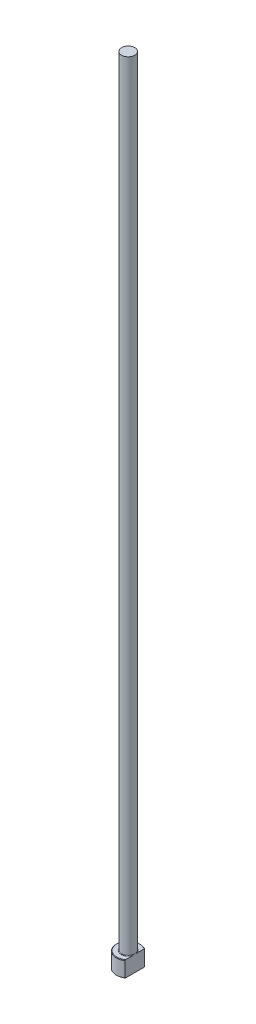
SolidWorks part; units mm, degrees
ref_plane "Front Plane" through (0, 0, 0) normal (0, 0, 1) x (1, 0, 0)
ref_plane "Top Plane" through (0, 0, 0) normal (0, 1, 0) x (1, 0, 0)
ref_plane "Right Plane" through (0, 0, 0) normal (1, 0, 0) x (0, 0, -1)
sketch "Sketch1" plane through (0, 0, 0) normal (0, 0, 1) x (1, 0, 0)
  line L0 (0, 259.9588) -> (0, -15.1925) construction
  line L1 (0, 0) -> (-4.5, 0)
  line L2 (-4.5, 0) -> (-4.5, 6)
  line L3 (-4.5, 6) -> (-2.5, 6)
  line L4 (-2.5, 6) -> (-2.5, 300)
  line L5 (-2.5, 300) -> (0, 300)
  line L6 (0, 300) -> (0, 0)
  dimension "L" = 300
  dimension "H" = 9
  dimension "T" = 6
  dimension "D" = 5
revolve "Revolve1" add sketch "Sketch1" angle 360 about L0
chamfer "Chamfer1" distance 0.2 angle 45 2 edges at (0, 6, 4.5) (0, 0, 4.5)
fillet "Fillet1" radius 0.2 1 edges at (0, 6, 2.5)
sketch "Sketch2" plane through (0, 0, 0) normal (0, 1, 0) x (1, 0, 0)
  line L0 (2.5, -3.7417) -> (2.5, 3.7417)
  circle A0 centre (0, 0) radius 4.5 construction
  arc A1 (2.5, -3.7417) -> (2.5, 3.7417) centre (0, 0) ccw
  circle A2 centre (0, 0) radius 2.5 construction
extrude "KEYED HEAD" cut sketch "Sketch2" along normal through all
